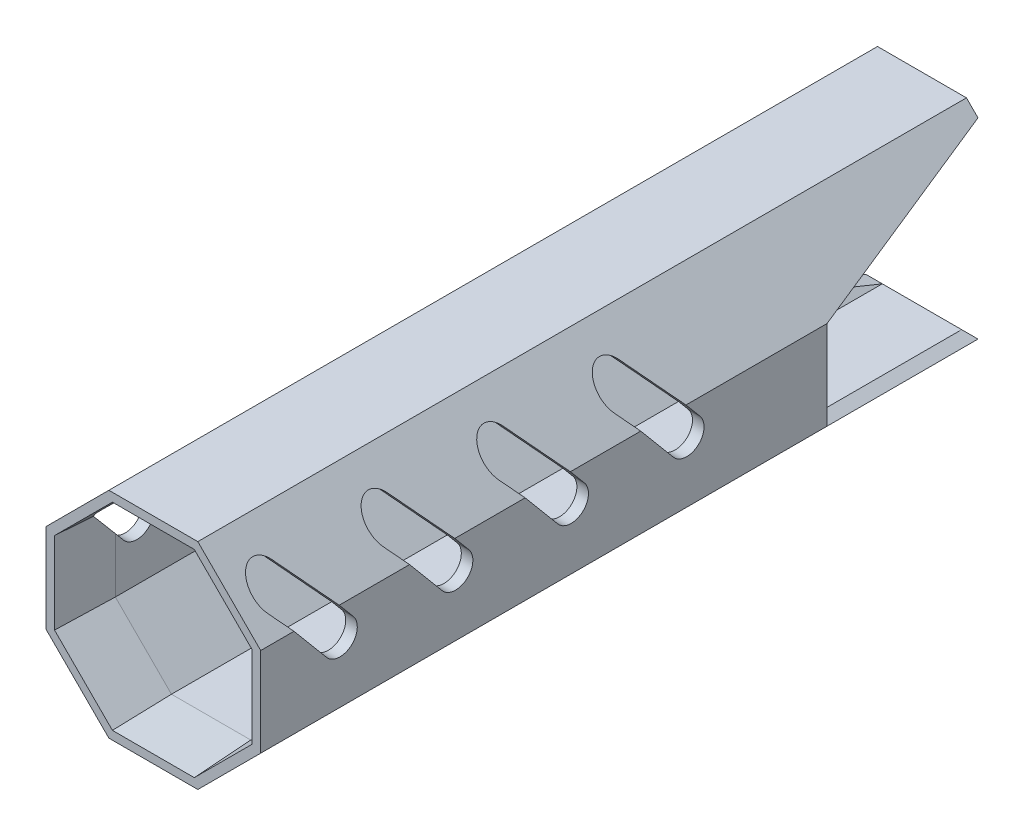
SolidWorks part; units mm, degrees
ref_plane "Front Plane" through (0, 0, 0) normal (0, 0, 1) x (1, 0, 0)
ref_plane "Top Plane" through (0, 0, 0) normal (0, 1, 0) x (1, 0, 0)
ref_plane "Right Plane" through (0, 0, 0) normal (1, 0, 0) x (0, 0, -1)
sketch "Sketch1" plane through (0, 0, 0) normal (0, 0, 1) x (1, 0, 0)
  line L0 (18.575, 7.694) -> (7.694, 18.575)
  line L1 (16.575, 6.8656) -> (6.8656, 16.575)
  line L2 (6.8656, 16.575) -> (-6.8656, 16.575)
  line L3 (-6.8656, 16.575) -> (-16.575, 6.8656)
  line L4 (-16.575, 6.8656) -> (-16.575, -6.8656)
  line L5 (-16.575, -6.8656) -> (-6.8656, -16.575)
  line L6 (-6.8656, -16.575) -> (6.8656, -16.575)
  line L7 (6.8656, -16.575) -> (16.575, -6.8656)
  line L8 (16.575, -6.8656) -> (16.575, 6.8656)
  line L9 (7.694, 18.575) -> (-7.694, 18.575)
  line L10 (-7.694, 18.575) -> (-18.575, 7.694)
  line L11 (-18.575, 7.694) -> (-18.575, -7.694)
  line L12 (-18.575, -7.694) -> (-7.694, -18.575)
  line L13 (-7.694, -18.575) -> (7.694, -18.575)
  line L14 (7.694, -18.575) -> (18.575, -7.694)
  line L15 (18.575, -7.694) -> (18.575, 7.694)
  circle A0 centre (0, 0) radius 16.575 construction
  dimension "D1" = 37.15
  dimension "D2" = 2
extrude "Boss-Extrude1" add sketch "Sketch1" along normal blind 247
sketch "Sketch2" plane through (0, 0, 247) normal (0, 0, 1) x (1, 0, 0)
  line L0 (-16.575, 6.8656) -> (-16.575, -6.8656) construction
  line L1 (-16.575, -6.8656) -> (-6.8656, -16.575) construction
  line L2 (-6.8656, -16.575) -> (6.8656, -16.575) construction
  line L3 (6.8656, -16.575) -> (16.575, -6.8656) construction
  line L4 (16.575, -6.8656) -> (16.575, 6.8656) construction
  line L5 (16.575, 6.8656) -> (6.8656, 16.575) construction
  line L6 (6.8656, 16.575) -> (-6.8656, 16.575) construction
  line L7 (-6.8656, 16.575) -> (-16.575, 6.8656) construction
  line L8 (-16.575, 6.8656) -> (-16.575, -6.8656)
  line L9 (-16.575, -6.8656) -> (-15.9576, -7.483)
  line L10 (-6.8656, -16.575) -> (-5.9925, -16.575)
  line L11 (6.8656, -16.575) -> (7.483, -15.9576)
  line L12 (16.575, -6.8656) -> (16.575, -5.9925)
  line L13 (16.575, 6.8656) -> (15.9576, 7.483)
  line L14 (6.8656, 16.575) -> (5.9925, 16.575)
  line L15 (-6.8656, 16.575) -> (-7.483, 15.9576)
  line L16 (-15.9576, 7.483) -> (-16.575, 6.8656)
  line L17 (-5.9925, 16.575) -> (-6.8656, 16.575)
  line L18 (7.483, 15.9576) -> (6.8656, 16.575)
  line L19 (16.575, 5.9925) -> (16.575, 6.8656)
  line L20 (15.9576, -7.483) -> (16.575, -6.8656)
  line L21 (5.9925, -16.575) -> (6.8656, -16.575)
  line L22 (-7.483, -15.9576) -> (-6.8656, -16.575)
  line L23 (-18.575, 7.694) -> (-18.575, -7.694) construction
  line L24 (-18.575, -7.694) -> (-7.694, -18.575) construction
  line L25 (-7.694, -18.575) -> (7.694, -18.575) construction
  line L26 (7.694, -18.575) -> (18.575, -7.694) construction
  line L27 (18.575, -7.694) -> (18.575, 7.694) construction
  line L28 (18.575, 7.694) -> (7.694, 18.575) construction
  line L29 (7.694, 18.575) -> (-7.694, 18.575) construction
  line L30 (-7.694, 18.575) -> (-18.575, 7.694) construction
  line L31 (-18.575, 7.694) -> (-18.575, -7.694)
  line L32 (-18.575, -7.694) -> (-7.694, -18.575)
  line L33 (-7.694, -18.575) -> (7.694, -18.575)
  line L34 (7.694, -18.575) -> (18.575, -7.694)
  line L35 (18.575, -7.694) -> (18.575, 7.694)
  line L36 (18.575, 7.694) -> (7.694, 18.575)
  line L37 (7.694, 18.575) -> (-7.694, 18.575)
  line L38 (-7.694, 18.575) -> (-18.575, 7.694)
  circle A0 centre (0, 0) radius 17.625
  dimension "D1" = 35.25
extrude "Cut-Extrude1" cut sketch "Sketch2" against normal blind 29.65 contours A0 L8 M27 M26 M33 M32 M30 M29 M28 | A0 M32 | A0 M33 | A0 M26 | A0 M27 | A0 M28 | A0 M29 | A0 M30 | L8 A0
sketch "Sketch3" plane through (0, 0, 247) normal (0, 0, 1) x (1, 0, 0)
  line L8 (18.575, -7.694) -> (18.575, 7.694)
  line L9 (18.575, 7.694) -> (7.694, 18.575)
  line L10 (7.694, 18.575) -> (-7.694, 18.575)
  line L11 (-7.694, 18.575) -> (-18.575, 7.694)
  line L12 (-18.575, 7.694) -> (-18.575, -7.694)
  line L13 (-18.575, -7.694) -> (-7.694, -18.575)
  line L14 (-7.694, -18.575) -> (7.694, -18.575)
  line L15 (7.694, -18.575) -> (18.575, -7.694)
  line L16 (18.575, -7.694) -> (18.575, 7.694)
  line L17 (18.575, 7.694) -> (7.694, 18.575)
  line L18 (7.694, 18.575) -> (-7.694, 18.575)
  line L19 (-7.694, 18.575) -> (-18.575, 7.694)
  line L20 (-18.575, 7.694) -> (-18.575, -7.694)
  line L21 (-18.575, -7.694) -> (-7.694, -18.575)
  line L22 (-7.694, -18.575) -> (7.694, -18.575)
  line L23 (7.694, -18.575) -> (18.575, -7.694)
  circle A0 centre (0, 0) radius 17.625
  dimension "D2" = 35.25
  dimension "D1" = 0
extrude "Boss-Extrude2" add sketch "Sketch3" against normal up to surface (29.65 mm away)
sketch "Sketch4" plane through (0, 0, 247) normal (0, 0, 1) x (1, 0, 0)
  line L0 (3.25, 17.3228) -> (3.25, 15.2168)
  line L2 (-3.25, 15.2168) -> (-3.25, 17.3228)
  circle A0 centre (0, 0) radius 17.625 construction
  circle A1 centre (0, 0) radius 17.625
  arc A2 (3.25, 15.2168) -> (-3.25, 15.2168) centre (0, 0) ccw
extrude "Boss-Extrude3" add sketch "Sketch4" against normal blind 4.8 contours A2 L0 L2 M5
mirror "Mirror1" about plane through (0, 0, 0) normal (0, 1, 0) of "Boss-Extrude3"
fillet "Fillet1" radius 1 8 edges at (3.25, -16.2698, 242.2) (-3.25, -16.2698, 242.2) (-3.25, -16.2698, 247) (3.25, -16.2698, 247) (3.25, 16.2698, 242.2) (-3.25, 16.2698, 242.2) (-3.25, 16.2698, 247) (3.25, 16.2698, 247)
sketch "Sketch5" plane through (0, 0, 0) normal (1, 0, 0) x (0, 0, -1)
  line L0 (-237.058, 18.575) -> (-247, 24.315)
  line L1 (-247, 18.575) -> (0, 18.575) construction
  line L2 (-247, 24.315) -> (-247, 18.575)
  line L3 (-247, 18.575) -> (-237.058, 18.575)
  dimension "D1" = 5.74
  dimension "D2" = 30
extrude "Boss-Extrude4" add sketch "Sketch5" along normal up to vertex (7.694 mm away) and the other way up to vertex (7.694 mm away) contours L0 L2 L3
sketch "Sketch9" plane through (0, 0, 217.35) normal (0, 0, 1) x (1, 0, 0)
  arc A1 (2.25, -17.4808) -> (2.25, 17.4808) centre (0, 0) ccw construction
  arc A5 (2.25, -17.4808) -> (2.25, 17.4808) centre (0, 0) ccw
  circle A6 centre (0, 0) radius 17.625
  circle A7 centre (0, 0) radius 13
  dimension "D1" = 26
extrude "Boss-Extrude6" add sketch "Sketch9" along normal blind 15
chamfer "Chamfer1" distance 3 angle 60 8 edges at (16.575, 0, 217.35) (11.7203, 11.7203, 217.35) (0, 16.575, 217.35) (-11.7203, 11.7203, 217.35) (-16.575, 0, 217.35) (-11.7203, -11.7203, 217.35) (0, -16.575, 217.35) (11.7203, -11.7203, 217.35)
sketch "Sketch12" plane through (-18.575, 0, 0) normal (-1, 0, 0) x (0, 0, 1)
  line L1 (276.4146, -29.9752) -> (-13.2385, -29.9752)
  line L2 (276.4146, -29.9752) -> (276.4146, 32.1834)
  line L3 (276.4146, 32.1834) -> (-13.2385, 32.1834)
  line L4 (-13.2385, -29.9752) -> (-13.2385, 32.1834)
extrude "TRIAL PRINT CUT" [suppressed] cut sketch "Sketch12" against normal through all both and the other way through all
sketch "Sketch13" plane through (18.575, 0, 0) normal (1, 0, 0) x (0, 0, -1)
  line L0 (-219.2981, 10.1466) -> (-211.5847, 0.9541)
  line L1 (-247, -7.694) -> (0, -7.694) construction
  line L2 (-206.9884, 4.8108) -> (-214.7019, 14.0034)
  line L3 (-237.058, 18.575) -> (0, 18.575) construction
  line L4 (-247, 7.694) -> (-247, 18.575) construction
  arc A0 (-214.7019, 14.0034) -> (-219.2981, 10.1466) centre (-217, 12.075) ccw
  arc A1 (-211.5847, 0.9541) -> (-206.9884, 4.8108) centre (-209.2865, 2.8825) ccw
  dimension "D1" = 6
  dimension "D2" = 12
  dimension "D3" = 50
  dimension "D4" = 6.5
  dimension "D5" = 30
extrude "Cut-Extrude2" cut sketch "Sketch13" against normal through all
sketch "Sketch16" plane through (0, 18.575, 0) normal (0, 1, 0) x (1, 0, 0)
  text T0 "FREE MEN DON\"T ASK" font "Century Gothic" height 15.3
extrude "Cut-Extrude4" [suppressed] cut sketch "Sketch16" against normal blind 0.75
sketch "Sketch17" plane through (18.575, 0, 0) normal (1, 0, 0) x (0, 0, -1)
  line L0 (0, 7.694) -> (0, 18.575) construction
  line L1 (2, -34.425) -> (-103, -34.425)
  line L2 (2, -34.425) -> (2, 40.575)
  line L3 (2, 40.575) -> (-103, 40.575)
  line L4 (-103, -34.425) -> (-103, 40.575)
  line L5 (-237.058, 18.575) -> (0, 18.575) construction
  line L8 (-103, 40.575) -> (-103, -34.425)
  line L11 (-103, 40.575) -> (-123, 40.575)
  line L12 (-103, 40.575) -> (-103, -34.425)
  line L13 (-103, -34.425) -> (-123, -34.425)
  line L14 (-123, 40.575) -> (-123, -34.425)
  line L15 (-123, 40.575) -> (-266.3693, 40.575)
  line L16 (-123, 40.575) -> (-123, -34.425)
  line L17 (-123, -34.425) -> (-266.3693, -34.425)
  line L18 (-266.3693, 40.575) -> (-266.3693, -34.425)
  dimension "D1" = 105
  dimension "D2" = 103
  dimension "D3" = 22
  dimension "D4" = 75
  dimension "D5" = 20
extrude "Cut-Extrude5" cut sketch "Sketch17" against normal through all both and the other way through all
chamfer "Chamfer2" distance 10 angle 3 8 edges at (-11.7203, -11.7203, 123) (0, -16.575, 123) (11.7203, -11.7203, 123) (16.575, 0, 123) (11.7203, 11.7203, 123) (0, 16.575, 123) (-11.7203, 11.7203, 123) (-16.575, 0, 123)
pattern_linear "LPattern1" count 9 spacing 20 along (0, 0, -1) of "Cut-Extrude2"
sketch "Sketch18" plane through (0, 0, 0) normal (0, 0, -1) x (-1, 0, 0)
  line L0 (-16.575, 6.8656) -> (-6.8656, 16.575) construction
  line L1 (-6.8656, 16.575) -> (6.8656, 16.575) construction
  line L2 (6.8656, 16.575) -> (16.575, 6.8656) construction
  line L3 (16.575, 6.8656) -> (16.575, -6.8656) construction
  line L4 (16.575, -6.8656) -> (6.8656, -16.575) construction
  line L5 (6.8656, -16.575) -> (-6.8656, -16.575) construction
  line L6 (-6.8656, -16.575) -> (-16.575, -6.8656) construction
  line L7 (-16.575, -6.8656) -> (-16.575, 6.8656) construction
  line L8 (-18.575, 7.694) -> (-18.575, -7.694)
  line L9 (-18.575, -7.694) -> (-7.694, -18.575)
  line L10 (-18.575, -7.694) -> (-7.694, -18.575)
  line L11 (-7.694, -18.575) -> (7.694, -18.575)
  line L12 (-7.694, -18.575) -> (7.694, -18.575)
  line L13 (7.694, -18.575) -> (18.575, -7.694)
  line L14 (7.694, -18.575) -> (18.575, -7.694)
  line L15 (18.575, -7.694) -> (18.575, 7.694)
  line L16 (-18.575, 7.694) -> (-18.575, -7.694)
  line L24 (-16.575, 6.8656) -> (-6.8656, 16.575)
  line L25 (-6.8656, 16.575) -> (6.8656, 16.575)
  line L26 (6.8656, 16.575) -> (16.575, 6.8656)
  line L27 (16.575, 6.8656) -> (16.575, -6.8656)
  line L28 (16.575, -6.8656) -> (6.8656, -16.575)
  line L29 (6.8656, -16.575) -> (-6.8656, -16.575)
  line L30 (-6.8656, -16.575) -> (-16.575, -6.8656)
  line L31 (-16.575, -6.8656) -> (-16.575, 6.8656)
  line L38 (18.575, -7.694) -> (18.575, 7.694)
  line L39 (18.575, 7.694) -> (7.694, 18.575)
  line L40 (18.575, 7.694) -> (7.694, 18.575)
  line L43 (7.694, 18.575) -> (-7.694, 18.575)
  line L44 (7.694, 18.575) -> (-7.694, 18.575)
  line L45 (-7.694, 18.575) -> (-18.575, 7.694)
  line L46 (-7.694, 18.575) -> (-18.575, 7.694)
  dimension "D1" = 0
extrude "Boss-Extrude7" add sketch "Sketch18" along normal blind 10
sketch "Sketch14" plane through (18.575, 0, 0) normal (1, 0, 0) x (0, 0, -1)
  line L0 (-123, -18.575) -> (10, -18.575) construction
  line L1 (-123, -7.694) -> (10, -7.694) construction
  line L3 (-123, 18.575) -> (10, 18.575) construction
  line L4 (-123, -18.575) -> (10, -18.575)
  line L5 (-123, -7.694) -> (10, -7.694)
  line L7 (-123, 18.575) -> (10, 18.575)
  line L8 (-25, 7.694) -> (10, 16.575)
  line L9 (-25, 7.694) -> (-25, -7.694)
  line L10 (10, -16.575) -> (-25, -7.694)
  line L11 (-113, -16.575) -> (10, -16.575) construction
  line L12 (-113, 16.575) -> (10, 16.575) construction
  line L13 (-113, -16.575) -> (10, -16.575)
  line L14 (-113, 16.575) -> (10, 16.575)
  line L15 (10, -16.575) -> (10, 16.575)
  dimension "D1" = 35
extrude "Cut-Extrude3" cut sketch "Sketch14" against normal through all both and the other way through all
equation "\"D3@Sketch4\"=\"D1@Sketch4\"/2"
